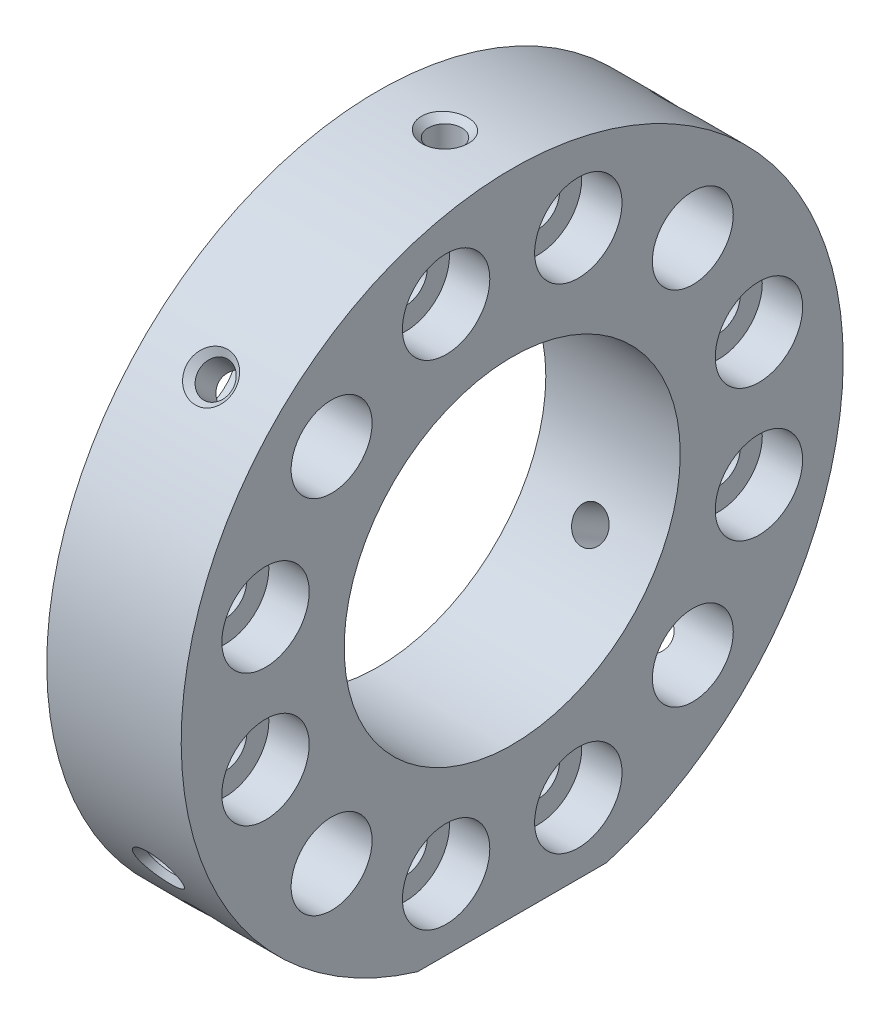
SolidWorks part; units mm, degrees
ref_plane "Front Plane" through (0, 0, 0) normal (0, 0, 1) x (1, 0, 0)
ref_plane "Top Plane" through (0, 0, 0) normal (0, 1, 0) x (1, 0, 0)
ref_plane "Right Plane" through (0, 0, 0) normal (1, 0, 0) x (0, 0, -1)
sketch "Sketch1" plane through (0, 0, 0) normal (1, 0, 0) x (0, 0, -1)
  circle A0 centre (0, 0) radius 12.5
  circle A1 centre (0, 0) radius 24.625
  circle A2 centre (0, 0) radius 19 construction
  dimension "D1" = 49.25
  dimension "D2" = 25
  dimension "D3" = 38
extrude "Boss-Extrude1" add sketch "Sketch1" along normal blind 10
hole_wizard "Ø3.0 (3) Diameter Hole1" positions "Sketch3" profile "Sketch2" hole size "Ø3.0" standard "Ansi Metric"
sketch "Sketch3" plane through (10, 0, 0) normal (1, 0, 0) x (0, 0, -1)
  line L0 (0, 0) -> (13.435, 13.435) construction
  line L1 (0, 0) -> (8.7822, 0) construction
  circle A1 centre (0, 0) radius 19 construction
  point P0 (13.435, 13.435)
  dimension "D2" = 45
sketch "Sketch2" plane through (10, 13.435, -13.435) normal (0, 1, 0) x (0, 0, -1)
  line L0 (0, 0) -> (0, 10)
  line L1 (0, 10) -> (3.01, 10)
  line L2 (3.01, 10) -> (3.01, 0)
  line L5 (3.01, 0) -> (0, 0)
  line L11 (0, -6.35) -> (0, 107.95) construction
  dimension "Thru Hole Dia." = 6.02
  dimension "Thru Hole Depth" = 10
hole_wizard "CBORE for M3 SHCS1" positions "Sketch5" profile "Sketch4" counterbore size "M3" standard "Ansi Metric"
sketch "Sketch5" plane through (10, 0, 0) normal (1, 0, 0) x (0, 0, -1)
  line L0 (18.3526, 4.9176) -> (0, 0) construction
  line L1 (0, 0) -> (13.435, 13.435) construction
  circle A1 centre (0, 0) radius 19 construction
  point P0 (18.3526, 4.9176)
  dimension "D1" = 30
sketch "Sketch4" plane through (10, 4.9176, -18.3526) normal (0, 1, 0) x (0, 0, -1)
  line L0 (0, 0) -> (0, 10)
  line L1 (0, 10) -> (1.6, 10)
  line L3 (1.6, 10) -> (1.6, 3)
  line L4 (1.6, 3) -> (3.25, 3)
  line L5 (3.25, 3) -> (3.25, 0)
  line L7 (3.25, 0) -> (0, 0)
  line L11 (0, -6.35) -> (0, 107.95) construction
  dimension "Thru Hole Dia." = 3.2
  dimension "Thru Hole Depth" = 10
  dimension "C'Bore Dia." = 6.5
  dimension "C'Bore Depth" = 3
pattern_circular "CirPattern2" count 2 every 60 about axis through (10, 0, 0) along (-1, 0, 0) of "CBORE for M3 SHCS1"
pattern_circular "CirPattern3" count 4 over 360 about axis through (0, 0, 0) along (1, 0, 0) of "CirPattern2", "CBORE for M3 SHCS1"
hole_wizard "M3x0.5 Tapped Hole1" positions "3DSketch1" profile "Sketch6" tap size "M3x0.5" standard "Ansi Metric"
sketch3d "3DSketch1"
  line L0 (5, 24.625, 0) -> (5, 0, 0) construction
  line L1 (5, 0, 0) -> (0, 0, 0) construction
  point P0 (5, 24.625, 0)
  dimension "D1" = 5
sketch "Sketch6" plane through (5, 24.625, 0) normal (1, 0, 0) x (0, 0, 1)
  line L0 (0, 0) -> (0, 49.25)
  line L1 (0, 49.25) -> (1.25, 49.25)
  line L2 (1.25, 49.25) -> (1.25, 0.5)
  line L3 (1.25, 0.5) -> (1.75, 0)
  line L5 (1.75, 0) -> (0, 0)
  line L6 (-1.25, 0.5) -> (-1.75, 0) construction
  line L11 (0, -6.35) -> (0, 107.95) construction
  dimension "Thru Tap Drill Dia." = 2.5
  dimension "Thru Tap Drill Depth" = 49.25
  dimension "Near C'Sink Dia." = 3.5
  dimension "Near C'Sink Angle" = 90
pattern_circular "CirPattern4" count 3 over 360 about axis through (10, 0, 0) along (-1, 0, 0) of "M3x0.5 Tapped Hole1"
pattern_circular "CirPattern1" count 4 over 360 about axis through (0, 0, 0) along (1, 0, 0) of "Ø3.0 (3) Diameter Hole1"
pattern_circular "CirPattern5" count 8 every 45 about axis through (10, 0, 0) along (-1, 0, 0) of "M3x0.5 Tapped Hole1"
sketch "Sketch7" plane through (10, 0, 0) normal (1, 0, 0) x (0, 0, -1)
  line L1 (-17.188, -23.6) -> (17.1748, -23.6)
  line L2 (-17.188, -23.6) -> (-17.188, -31.8368)
  line L3 (-17.188, -31.8368) -> (17.1748, -31.8368)
  line L4 (17.1748, -23.6) -> (17.1748, -31.8368)
  circle A0 centre (0, 0) radius 24.625 construction
  dimension "D1" = 23.6
extrude "Cut-Extrude1" cut sketch "Sketch7" against normal through all
hole_wizard "M6x1.0 Tapped Hole2" positions "Sketch11" profile "Sketch10" tap size "M6x1.0" standard "Ansi Metric"
sketch "Sketch11" plane through (0, -23.6, 0) normal (0, -1, 0) x (1, 0, 0)
  line L0 (10, -7.0307) -> (10, 7.0307) construction
  point P0 (5, 0)
  dimension "D1" = 5
sketch "Sketch10" plane through (5, -23.6, 0) normal (1, 0, 0) x (0, 0, -1)
  line L0 (0, 0) -> (0, 7)
  line L1 (0, 7) -> (2.5, 7)
  line L2 (2.5, 7) -> (2.5, 0)
  line L5 (2.5, 0) -> (0, 0)
  line L10 (0, 7) -> (-2.5, 7) construction
  line L11 (0, -6.35) -> (0, 107.95) construction
  dimension "Tap Drill Dia." = 5
  dimension "Tap Drill Depth" = 7
  dimension "Drill Angle" = 180
sketch "Sketch12" plane through (10, 0, 0) normal (1, 0, 0) x (0, 0, -1)
  circle A0 centre (0, 0) radius 15.99 construction
  circle A1 centre (13.435, 13.435) radius 3.01 construction
  dimension "D1" = 31.98
